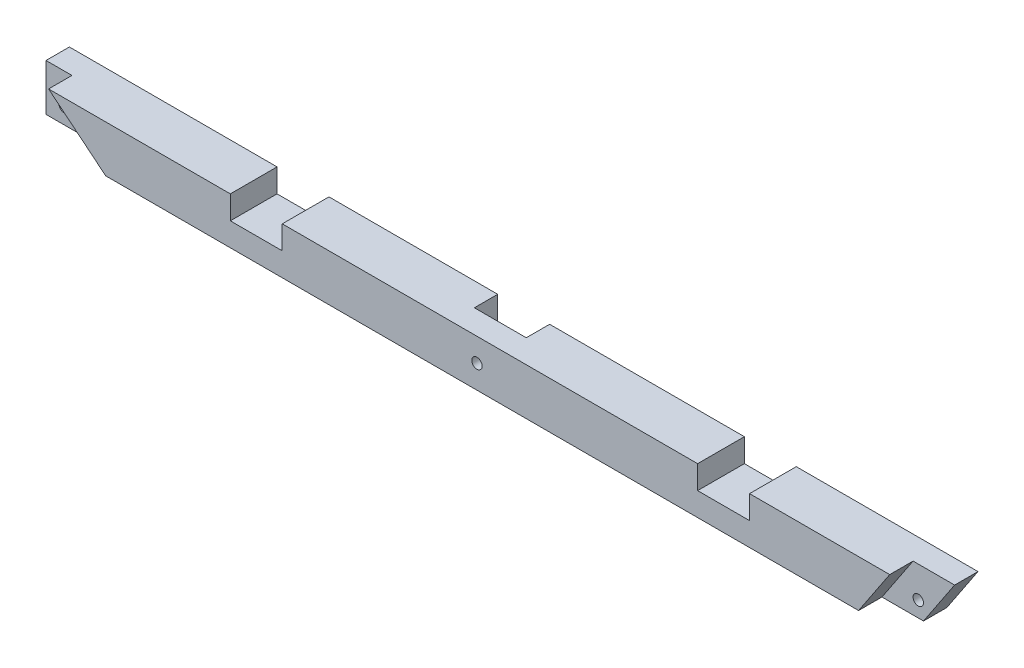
SolidWorks part; units mm, degrees
ref_plane "Plan de face" through (0, 0, 0) normal (0, 0, 1) x (1, 0, 0)
ref_plane "Plan de dessus" through (0, 0, 0) normal (0, 1, 0) x (1, 0, 0)
ref_plane "Plan de droite" through (0, 0, 0) normal (1, 0, 0) x (0, 0, -1)
sketch "Esquisse1" plane through (0, 0, 0) normal (0, 0, 1) x (1, 0, 0)
  line L1 (0, 0) -> (175, 0)
  line L2 (0, 0) -> (0, 9)
  line L3 (0, 9) -> (175, 9)
  line L4 (175, 0) -> (175, 9)
  dimension "D1" = 175
  dimension "D2" = 9
extrude "Extrusion1" add sketch "Esquisse1" along normal blind 9
sketch "Esquisse2" plane through (0, 0, 9) normal (0, 0, 1) x (1, 0, 0)
  line L0 (0, 9) -> (5, 9)
  line L1 (175, 9) -> (0, 9) construction
  line L2 (5, 9) -> (16, 0)
  line L3 (0, 0) -> (175, 0) construction
  line L4 (16, 0) -> (0, 0)
  line L5 (0, 0) -> (0, 9)
  dimension "D1" = 5
  dimension "D2" = 16
extrude "Enlèv. mat.-Extru.1" cut sketch "Esquisse2" against normal blind 4.5
sketch "Esquisse3" plane through (0, 0, 4.5) normal (0, 0, 1) x (1, 0, 0)
  line L0 (0, 9) -> (0, 0) construction
  line L1 (0, 0) -> (16, 0) construction
  circle A0 centre (3.5, 3) radius 1
  dimension "D3" = 2
  dimension "D1" = 3.5
  dimension "D2" = 3
extrude "Enlèv. mat.-Extru.2" cut sketch "Esquisse3" against normal blind 4.5
sketch "Esquisse4" plane through (0, 0, 9) normal (0, 0, 1) x (1, 0, 0)
  line L0 (175, 9) -> (169, 0)
  line L1 (16, 0) -> (175, 0) construction
  line L2 (169, 0) -> (175, 0)
  line L3 (175, 0) -> (175, 9) construction
  line L4 (175, 0) -> (175, 9)
  dimension "D1" = 6
extrude "Enlèv. mat.-Extru.3" cut sketch "Esquisse4" against normal blind 9
sketch "Esquisse5" plane through (0, 0, 9) normal (0, 0, 1) x (1, 0, 0)
  line L0 (175, 9) -> (167, 9)
  line L1 (175, 9) -> (5, 9) construction
  line L2 (167, 9) -> (161, 0)
  line L3 (16, 0) -> (169, 0) construction
  line L4 (161, 0) -> (169, 0)
  line L5 (169, 0) -> (175, 9)
  dimension "D1" = 8
  dimension "D2" = 8
extrude "Enlèv. mat.-Extru.4" cut sketch "Esquisse5" against normal blind 4.5
sketch "Esquisse6" plane through (0, 0, 4.5) normal (0, 0, 1) x (1, 0, 0)
  line L0 (161, 0) -> (169, 0) construction
  circle A0 centre (168, 3) radius 1
  dimension "D3" = 2
  dimension "D1" = 3
  dimension "D2" = 7
extrude "Enlèv. mat.-Extru.5" cut sketch "Esquisse6" against normal blind 4.5
sketch "Esquisse7" plane through (0, 0, 0) normal (0, 0, -1) x (-1, 0, 0)
  line L0 (0, 0) -> (-169, 0) construction
  line L1 (-92.5, 0) -> (-82.5, 0)
  line L2 (-92.5, 0) -> (-92.5, 9)
  line L3 (-92.5, 9) -> (-82.5, 9)
  line L4 (-82.5, 0) -> (-82.5, 9)
  line L5 (-175, 9) -> (0, 9) construction
  dimension "D1" = 82.5
  dimension "D2" = 10
extrude "Enlèv. mat.-Extru.6" cut sketch "Esquisse7" against normal blind 4.5
sketch "Esquisse8" plane through (0, 0, 4.5) normal (0, 0, -1) x (-1, 0, 0)
  line L0 (-92.5, 0) -> (-82.5, 0) construction
  line L1 (-82.5, 0) -> (-82.5, 9) construction
  circle A0 centre (-87.5, 4.5) radius 1
  dimension "D3" = 2
  dimension "D1" = 4.5
  dimension "D2" = 5
extrude "Enlèv. mat.-Extru.7" cut sketch "Esquisse8" against normal blind 4.5
sketch "Esquisse9" plane through (0, 0, 0) normal (0, 0, -1) x (-1, 0, 0)
  line L0 (-82.5, 9) -> (0, 9) construction
  line L1 (-40, 9) -> (-50, 9)
  line L2 (-40, 9) -> (-40, 4.5)
  line L3 (-40, 4.5) -> (-50, 4.5)
  line L4 (-50, 9) -> (-50, 4.5)
  line L5 (-175, 9) -> (-92.5, 9) construction
  line L6 (-130, 9) -> (-140, 9)
  line L7 (-130, 9) -> (-130, 4.5)
  line L8 (-130, 4.5) -> (-140, 4.5)
  line L9 (-140, 9) -> (-140, 4.5)
  dimension "D1" = 10
  dimension "D2" = 10
  dimension "D3" = 40
  dimension "D4" = 80
  dimension "D5" = 4.5
  dimension "D6" = 4.5
extrude "Enlèv. mat.-Extru.8" cut sketch "Esquisse9" against normal blind 9
